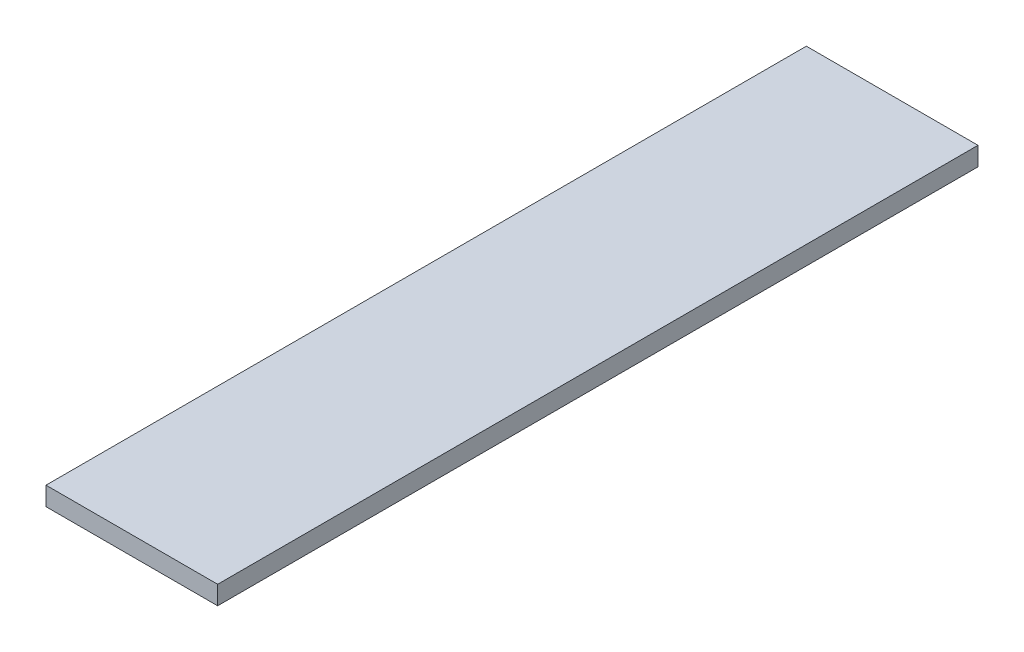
SolidWorks part; units mm, degrees
ref_plane "Front Plane" through (0, 0, 0) normal (0, 0, 1) x (1, 0, 0)
ref_plane "Top Plane" through (0, 0, 0) normal (0, 1, 0) x (1, 0, 0)
ref_plane "Right Plane" through (0, 0, 0) normal (1, 0, 0) x (0, 0, -1)
sketch "Sketch1" plane through (0, 0, 0) normal (0, 1, 0) x (1, 0, 0)
  line L1 (-584.2, 2587.6707) -> (584.2, 2587.6707)
  line L2 (-584.2, 2587.6707) -> (-584.2, -2587.6707)
  line L3 (-584.2, -2587.6707) -> (584.2, -2587.6707)
  line L4 (584.2, 2587.6707) -> (584.2, -2587.6707)
  line L5 (-584.2, 2587.6707) -> (584.2, -2587.6707) construction
  line L6 (-584.2, -2587.6707) -> (584.2, 2587.6707) construction
  point P0 (0, 0)
  dimension "D1" = 1168.4
  dimension "D2" = 5175.3414
extrude "Boss-Extrude1" add sketch "Sketch1" along normal blind 127
